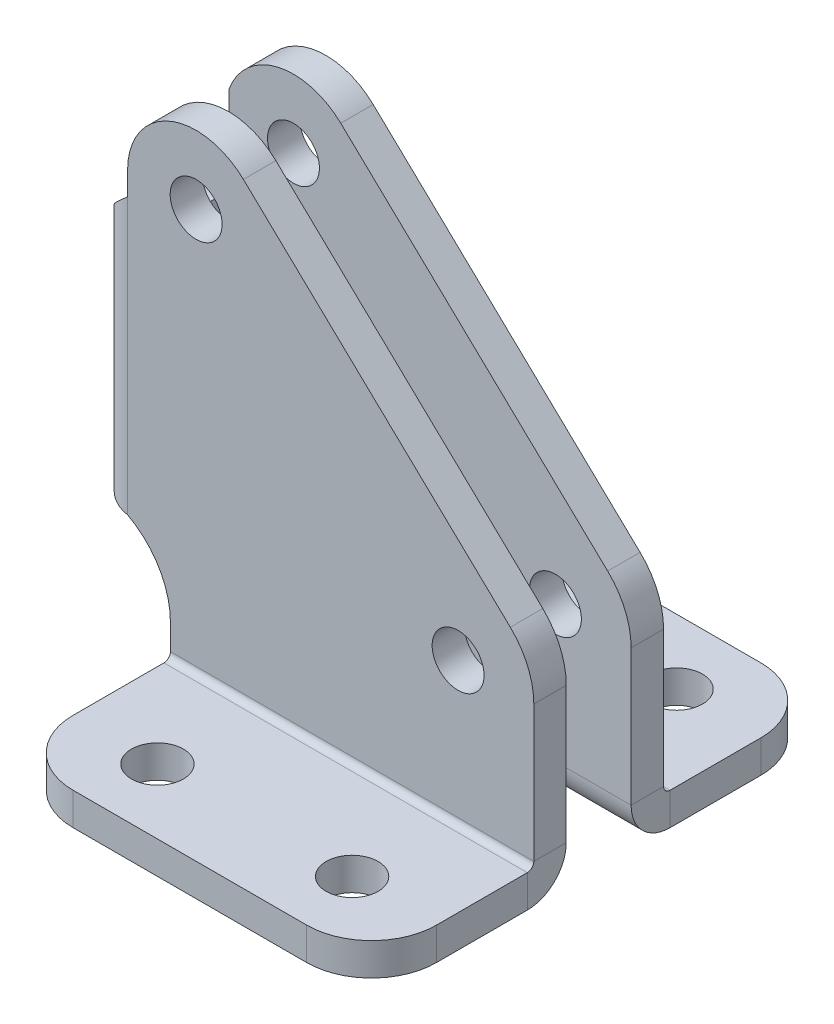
SolidWorks part; units mm, degrees
ref_plane "Plane1" through (0, 0, 0) normal (0, 0, 1) x (1, 0, 0)
ref_plane "Plane2" through (0, 0, 0) normal (0, 1, 0) x (-1, 0, 0)
ref_plane "Plane3" through (0, 0, 0) normal (1, 0, 0) x (0, 0, -1)
sketch "Sketch1" plane through (0, 0, 0) normal (0, 1, 0) x (-1, 0, 0)
  line L0 (0, 0) -> (-42.926, 0)
  line L1 (-42.926, 0) -> (-42.926, -3.175)
  line L2 (-42.926, -3.175) -> (-3.175, -3.175)
  line L3 (-3.175, -3.175) -> (-3.175, -9.525)
  line L4 (-3.175, -9.525) -> (-42.926, -9.525)
  line L5 (-42.926, -9.525) -> (-42.926, -12.7)
  line L6 (-42.926, -12.7) -> (0, -12.7)
  line L7 (0, -12.7) -> (0, 0)
  dimension "D1" = 42.926
  dimension "D2" = 3.175
  dimension "D3" = 3.175
  dimension "D4" = 6.35
extrude "Base-Extrude" add sketch "Sketch1" along normal blind 50.8
sketch "Sketch2" plane through (0, 0, 0) normal (0, 0, 1) x (1, 0, 0)
  line L0 (7.366, 0) -> (7.366, 6.3071)
  line L1 (0, 0) -> (42.926, 0) construction
  line L2 (42.926, 50.8) -> (42.926, 0) construction
  line L3 (0, 50.8) -> (0, 0) construction
  arc A0 (7.366, 6.3071) -> (0, 14.224) centre (-0.5715, 6.3071) ccw
  dimension "D2" = 7.9375
  dimension "D1" = 35.56
  dimension "D3" = 14.224
extrude "Cut-Extrude1" cut sketch "Sketch2" against normal through all
sketch "Sketch5" plane through (0, 0, 0) normal (0, 0, 1) x (1, 0, 0)
  line L0 (3.175, 50.8) -> (3.175, 13.3048) construction
  line L1 (3.175, 50.8) -> (3.175, 40.259)
  line L2 (0, 50.8) -> (0, 14.224) construction
  arc A0 (3.175, 40.259) -> (0, 35.814) centre (-1.524, 40.259) cw
  dimension "D2" = 4.699
  dimension "D1" = 14.986
extrude "Cut-Extrude5" cut sketch "Sketch5" against normal through all flip side to cut
fillet "Fillet7" radius 3.175 4 edges at (0, 25.019, -12.7) (2.2997, 37.5278, -12.7) (0, 25.019, 0) (2.2997, 37.5278, 0)
sketch "Sketch6" plane through (0, 0, 0) normal (0, -1, 0) x (1, 0, 0)
  line L0 (3.175, -9.525) -> (3.175, -3.175) construction
  line L1 (38.1468, -6.35) -> (3.175, -6.35) construction
  line L2 (42.926, -3.175) -> (7.366, -3.175)
  line L3 (42.926, -3.175) -> (42.926, 15.875)
  line L4 (7.366, 15.875) -> (42.926, 15.875)
  line L5 (7.366, 15.875) -> (7.366, -3.175)
  line L6 (7.366, 0) -> (7.366, -3.175) construction
  line L7 (7.366, -28.575) -> (7.366, -9.525)
  line L8 (7.366, -28.575) -> (42.926, -28.575)
  line L9 (42.926, -9.525) -> (42.926, -28.575)
  line L10 (42.926, -9.525) -> (7.366, -9.525)
  point P2 (42.5339, -2.9728)
  dimension "D1" = 19.05
extrude "Boss-Extrude1" add sketch "Sketch6" against normal blind 3.175
fillet "Fillet8" radius 0.635 2 edges at (25.146, 3.175, 0) (25.146, 3.175, -12.7)
fillet "Fillet9" radius 3.81 2 edges at (25.146, 0, -9.525) (25.146, 0, -3.175)
sketch "Sketch7"
  line L0 (3.175, -6.35) -> (43.9061, -6.35) construction
  line L1 (3.175, -9.525) -> (3.175, -3.175) construction
  line L2 (25.146, 15.875) -> (25.146, -12.2629) construction
  line L3 (7.366, 15.875) -> (42.926, 15.875) construction
  circle A0 centre (15.621, 9.525) radius 2.54
  circle A1 centre (34.671, 9.525) radius 2.54
  circle A2 centre (34.671, -22.225) radius 2.54
  circle A3 centre (15.621, -22.225) radius 2.54
  dimension "D3" = 5.08
  dimension "D1" = 9.525
  dimension "D2" = 15.875
fillet "Fillet10" radius 6.35 4 edges at (42.926, 1.5875, 15.875) (7.366, 1.5875, 15.875) (7.366, 1.5875, -28.575) (42.926, 1.5875, -28.575)
extrude "Cut-Extrude6" cut sketch "Sketch7" against normal through all
sketch "Sketch8" plane through (0, 0, 0) normal (0, 0, 1) x (1, 0, 0)
  line L0 (42.926, 3.175) -> (42.926, 0) construction
  circle A0 centre (9.8818, 42.545) radius 2.54
  circle A1 centre (35.5179, 17.145) radius 2.54
  dimension "D3" = 5.08
  dimension "D1" = 17.145
  dimension "D2" = 42.545
  dimension "D4" = 7.4081
  dimension "D5" = 33.0442
extrude "Cut-Extrude7" cut sketch "Sketch8" against normal through all
sketch "Sketch9" plane through (0, 0, 0) normal (0, 0, 1) x (1, 0, 0)
  line L0 (3.175, 50.8) -> (3.175, 40.259) construction
  line L1 (42.926, 50.8) -> (42.926, 3.81) construction
  line L2 (14.5087, 47.4001) -> (40.6287, 22.5078)
  line L3 (3.175, 50.8) -> (3.175, 42.545)
  line L4 (42.926, 50.8) -> (42.926, 17.145)
  line L5 (3.175, 50.8) -> (42.926, 50.8) construction
  line L6 (3.175, 50.8) -> (42.926, 50.8)
  arc A0 (14.5087, 47.4001) -> (3.175, 42.545) centre (9.8818, 42.545) ccw
  circle A1 centre (9.8818, 42.545) radius 2.54 construction
  arc A2 (42.926, 17.145) -> (40.6287, 22.5078) centre (35.5179, 17.145) ccw
  circle A3 centre (35.5179, 17.145) radius 2.54 construction
extrude "Cut-Extrude8" cut sketch "Sketch9" against normal through all
sheet metal parameters "Sheet-Metal1" parameters "D1"=0
bend "SharpBend2" bend angle 90 parameters "D1"=0, "D5"=1
flatten bends "Flatten-Bends1" parameters "D1"=0
sketch "Sharp-Sketch1" plane through (0, 0, 0) normal (0, 0, 1) x (1, 0, 0)
  line L0 (1.9282, 13.3048) -> (1.9282, 40.259) construction
  line L1 (-6.9155, 13.3048) -> (-6.9155, 40.259) construction
  line L2 (-47.9133, 2.0645) -> (-12.3533, 2.0645) construction
  line L3 (7.366, 2.0645) -> (42.926, 2.0645) construction
bend "SharpBend1" bend angle 90 parameters "D1"=0, "D5"=2
bend "RoundBend1" bend radius 0.635 bend angle 90 parameters "D5"=3
bend "RoundBend2" bend radius 0.635 bend angle 90 parameters "D5"=4
process bends "Process-Bends1" parameters "D1"=0
sketch "Flat-Sketch1" plane through (0, 0, 0) normal (0, 0, 1) x (1, 0, 0)
equation "\"D2@Sketch1\" = \"D3@Sketch1\""
